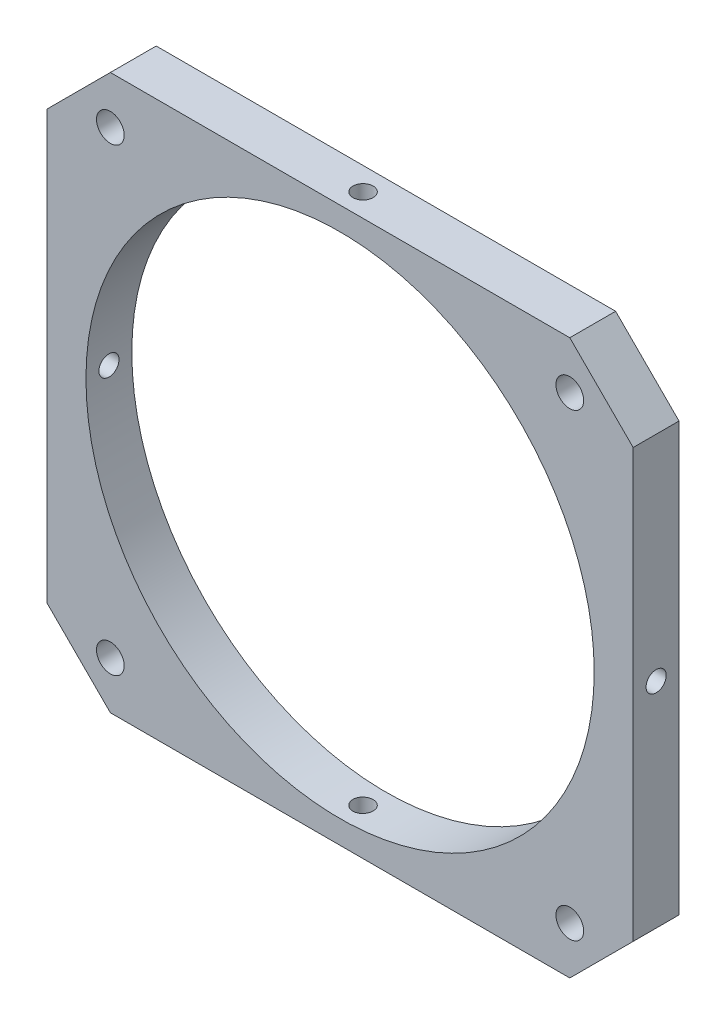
SolidWorks part; units mm, degrees
ref_plane "Front" through (0, 0, 0) normal (0, 0, 1) x (1, 0, 0)
ref_plane "Top" through (0, 0, 0) normal (0, 1, 0) x (1, 0, 0)
ref_plane "Right" through (0, 0, 0) normal (1, 0, 0) x (0, 0, -1)
sketch "Sketch2" plane through (0, 0, 0) normal (0, 0, 1) x (1, 0, 0)
  line L0 (0, 0) -> (0, 55.5625) construction
  line L1 (-46.0375, 55.5625) -> (46.0375, 55.5625)
  line L2 (-58.7375, 42.8625) -> (-58.7375, -42.8625)
  line L3 (-46.0375, -55.5625) -> (46.0375, -55.5625)
  line L4 (58.7375, 42.8625) -> (58.7375, -42.8625)
  line L5 (-58.7375, 42.8625) -> (-46.0375, 55.5625)
  line L6 (58.7375, 0) -> (0, 0) construction
  line L7 (46.0375, 55.5625) -> (58.7375, 42.8625)
  line L8 (46.0375, -55.5625) -> (58.7375, -42.8625)
  line L9 (-58.7375, -42.8625) -> (-46.0375, -55.5625)
  point P0 (-58.7375, 55.5625)
  point P1 (58.7375, -55.5625)
  point P2 (-58.7375, -55.5625)
  point P3 (58.7375, 55.5625)
  dimension "D1" = 111.125
  dimension "D2" = 117.475
sketch "Sketch1" plane through (0, 0, 0) normal (0, 0, 1) x (1, 0, 0)
  line L0 (-46.0375, -55.5625) -> (46.0375, -55.5625) construction
  line L1 (46.0375, -55.5625) -> (58.7375, -42.8625) construction
  line L2 (58.7375, 42.8625) -> (58.7375, -42.8625) construction
  line L3 (46.0375, 55.5625) -> (58.7375, 42.8625) construction
  line L4 (-46.0375, 55.5625) -> (46.0375, 55.5625) construction
  line L5 (-58.7375, 42.8625) -> (-46.0375, 55.5625) construction
  line L6 (-58.7375, 42.8625) -> (-58.7375, -42.8625) construction
  line L7 (-58.7375, -42.8625) -> (-46.0375, -55.5625) construction
  line L8 (-46.0375, -55.5625) -> (46.0375, -55.5625)
  line L9 (46.0375, -55.5625) -> (58.7375, -42.8625)
  line L10 (58.7375, 42.8625) -> (58.7375, -42.8625)
  line L11 (46.0375, 55.5625) -> (58.7375, 42.8625)
  line L12 (-46.0375, 55.5625) -> (46.0375, 55.5625)
  line L13 (-58.7375, 42.8625) -> (-46.0375, 55.5625)
  line L14 (-58.7375, 42.8625) -> (-58.7375, -42.8625)
  line L15 (-58.7375, -42.8625) -> (-46.0375, -55.5625)
  circle A0 centre (0, 0) radius 50.927
  dimension "D1" = 101.854
extrude "Boss-Extrude1" add sketch "Sketch1" along normal blind 19.05
sketch "Sketch3" plane through (0, 0, 0) normal (1, 0, 0) x (0, 0, -1)
  line L0 (0, 0) -> (-19.05, 0) construction
  line L2 (-19.05, -42.8625) -> (-19.05, 42.8625) construction
  point P5 (-14.4455, 0)
hole_wizard "#10-32 Tapped Hole1" positions "Sketch5" profile "Sketch4" tap size "#10-32" standard "Ansi Inch"
sketch "Sketch5" plane through (0, 0, 0) normal (1, 0, 0) x (0, 0, -1)
  point P1 (-14.4455, 0)
sketch "Sketch4" plane through (0, 0, 14.4455) normal (0, 1, 0) x (0, 0, 1)
  line L0 (0, 0) -> (0, 58.7375)
  line L1 (0, 58.7375) -> (2.0193, 58.7375)
  line L2 (2.0193, 58.7375) -> (2.0193, 0)
  line L5 (2.0193, 0) -> (0, 0)
  line L11 (0, -6.35) -> (0, 107.95) construction
  dimension "Thru Tap Drill Dia." = 4.0386
  dimension "Thru Tap Drill Depth" = 58.7375
pattern_circular "CirPattern1" count 4 over 360 about axis through (0, 0, 19.05) along (0, 0, -1) of "#10-32 Tapped Hole1"
hole_wizard "7/32 (0.21875) Diameter Hole1" positions "Sketch7" profile "Sketch6" hole size "7/32" standard "Ansi Inch"
sketch "Sketch7" plane through (0, 0, 19.05) normal (0, 0, 1) x (1, 0, 0)
  point P1 (-46.0375, -46.0375)
  point P4 (-46.0375, 46.0375)
  point P7 (46.0375, 46.0375)
  point P10 (46.0375, -46.0375)
sketch "Sketch6" plane through (-46.0375, -46.0375, 19.05) normal (1, 0, 0) x (0, -1, 0)
  line L0 (0, 0) -> (0, 19.05)
  line L1 (0, 19.05) -> (2.7781, 19.05)
  line L2 (2.7781, 19.05) -> (2.7781, 0)
  line L5 (2.7781, 0) -> (0, 0)
  line L11 (0, -6.35) -> (0, 107.95) construction
  dimension "Thru Hole Dia." = 5.5562
  dimension "Thru Hole Depth" = 19.05
sketch "Sketch8" plane through (0, 0, 0) normal (0, 0, -1) x (-1, 0, 0)
  line L0 (17.2369, 61.9125) -> (65.0875, 14.0619)
  line L1 (65.0875, 14.0619) -> (65.0875, 61.9125)
  line L2 (65.0875, 61.9125) -> (17.2369, 61.9125)
  line L6 (46.0375, 55.5625) -> (58.7375, 42.8625) construction
  line L7 (58.7375, 42.8625) -> (58.7375, -42.8625) construction
  line L8 (-46.0375, 55.5625) -> (46.0375, 55.5625) construction
  line L9 (65.0875, -61.9125) -> (65.0875, -14.0619)
  line L10 (65.0875, -14.0619) -> (17.2369, -61.9125)
  line L11 (17.2369, -61.9125) -> (65.0875, -61.9125)
  line L12 (0, 0) -> (0, 20.373) construction
  line L13 (-17.2369, -61.9125) -> (-65.0875, -61.9125)
  line L14 (-65.0875, -14.0619) -> (-17.2369, -61.9125)
  line L15 (-65.0875, -61.9125) -> (-65.0875, -14.0619)
  line L16 (-65.0875, 61.9125) -> (-17.2369, 61.9125)
  line L17 (-65.0875, 14.0619) -> (-65.0875, 61.9125)
  line L18 (58.7375, -42.8625) -> (46.0375, -55.5625) construction
  line L19 (-58.7375, -61.9125) -> (-10.8869, -61.9125)
  line L20 (-10.8869, -61.9125) -> (-58.7375, -14.0619)
  line L21 (-58.7375, -14.0619) -> (-58.7375, -61.9125)
  line L22 (-58.7375, 61.9125) -> (-58.7375, 14.0619)
  line L23 (-58.7375, 14.0619) -> (-10.8869, 61.9125)
  line L24 (-10.8869, 61.9125) -> (-58.7375, 61.9125)
  line L25 (-17.2369, 61.9125) -> (-65.0875, 14.0619)
  dimension "D1" = 15.875
  dimension "D2" = 6.35
  dimension "D3" = 6.35
  dimension "D5" = 15.875
  dimension "D4" = 4
extrude "Cut-Extrude1" cut sketch "Sketch8" against normal blind 10.3187
sketch "Sketch9" plane through (0, 0, 0) normal (1, 0, 0) x (0, 0, -1)
  line L0 (-10.3187, 62.0008) -> (-10.3187, -62.1528)
  line L1 (-10.3187, 42.8625) -> (-10.3187, 55.5625) construction
extrude "Cut-Extrude2" cut sketch "Sketch9" against normal through all and the other way through all
sketch "Sketch10" plane through (0, 0, 10.3187) normal (0, 0, -1) x (-1, 0, 0)
  line L8 (46.0375, 55.5625) -> (-46.0375, 55.5625)
  line L9 (-46.0375, 55.5625) -> (-58.7375, 42.8625)
  line L10 (-58.7375, 42.8625) -> (-58.7375, -42.8625)
  line L11 (-58.7375, -42.8625) -> (-46.0375, -55.5625)
  line L12 (-46.0375, -55.5625) -> (46.0375, -55.5625)
  line L13 (46.0375, -55.5625) -> (58.7375, -42.8625)
  line L14 (58.7375, -42.8625) -> (58.7375, 42.8625)
  line L15 (58.7375, 42.8625) -> (46.0375, 55.5625)
  line L16 (46.0375, 55.5625) -> (-46.0375, 55.5625)
  line L17 (-46.0375, 55.5625) -> (-58.7375, 42.8625)
  line L18 (-58.7375, 42.8625) -> (-58.7375, -42.8625)
  line L19 (-58.7375, -42.8625) -> (-46.0375, -55.5625)
  line L20 (-46.0375, -55.5625) -> (46.0375, -55.5625)
  line L21 (46.0375, -55.5625) -> (58.7375, -42.8625)
  line L22 (58.7375, -42.8625) -> (58.7375, 42.8625)
  line L23 (58.7375, 42.8625) -> (46.0375, 55.5625)
  circle A0 centre (0, 0) radius 50.927 construction
  circle A1 centre (46.0375, 46.0375) radius 2.7781 construction
  circle A2 centre (-46.0375, 46.0375) radius 2.7781 construction
  circle A3 centre (-46.0375, -46.0375) radius 2.7781 construction
  circle A4 centre (46.0375, -46.0375) radius 2.7781 construction
  circle A5 centre (0, 0) radius 50.927
  circle A6 centre (46.0375, 46.0375) radius 2.7781
  circle A7 centre (-46.0375, 46.0375) radius 2.7781
  circle A8 centre (-46.0375, -46.0375) radius 2.7781
  circle A9 centre (46.0375, -46.0375) radius 2.7781
  dimension "D1" = 0
extrude "Boss-Extrude2" add sketch "Sketch10" along normal blind 0.4572
